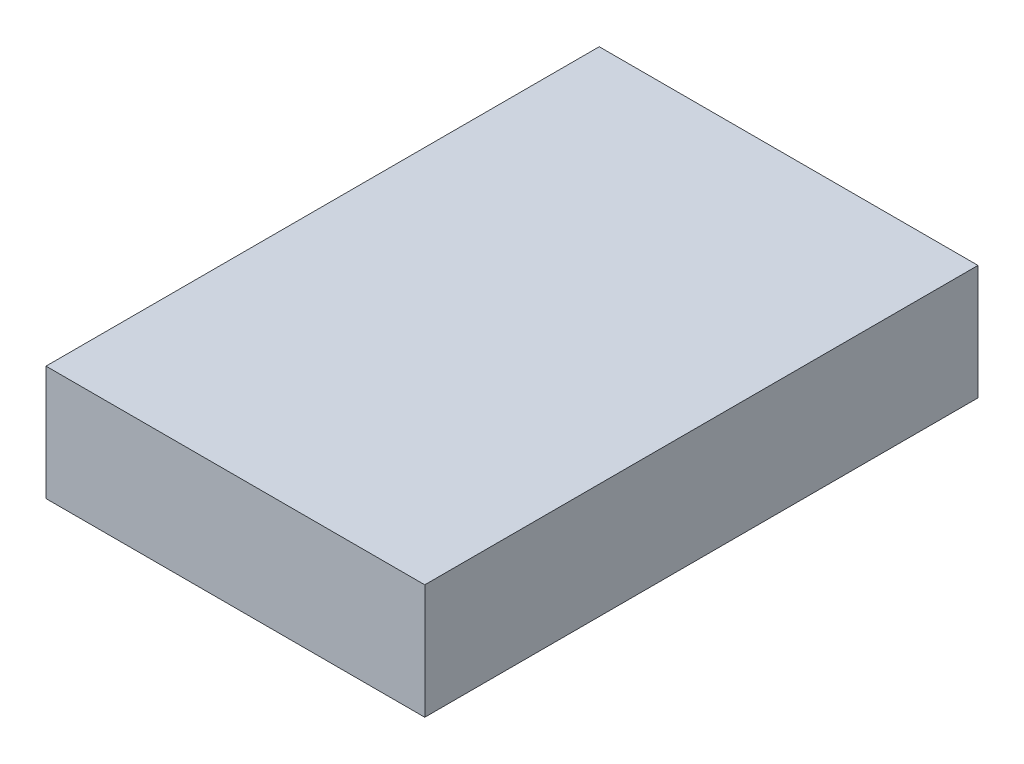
SolidWorks part; units mm, degrees
ref_plane "Front Plane" through (0, 0, 0) normal (0, 0, 1) x (1, 0, 0)
ref_plane "Top Plane" through (0, 0, 0) normal (0, 1, 0) x (1, 0, 0)
ref_plane "Right Plane" through (0, 0, 0) normal (1, 0, 0) x (0, 0, -1)
sketch "Sketch1" plane through (0, 0, 0) normal (0, 0, 1) x (1, 0, 0)
  line L1 (-97.5722, 21.2807) -> (22.9278, 21.2807)
  line L2 (-97.5722, 21.2807) -> (-97.5722, -15.2193)
  line L3 (-97.5722, -15.2193) -> (22.9278, -15.2193)
  line L4 (22.9278, 21.2807) -> (22.9278, -15.2193)
  dimension "D1" = 36.5
  dimension "D2" = 120.5
extrude "Boss-Extrude1" add sketch "Sketch1" along normal blind 176
ref_plane "Plane1" through (0, 0, 0) normal (0, 0, -1) x (-1, 0, 0)
sketch "Sketch2" plane through (0, 0, 0) normal (0, 0, -1) x (-1, 0, 0)
  line L0 (97.5722, -15.2193) -> (-22.9278, -15.2193) construction
  line L1 (97.5722, 21.2807) -> (97.5722, -15.2193) construction
  circle A0 centre (72.5722, -5.2193) radius 3
  dimension "D1" = 6
  dimension "D2" = 10
  dimension "D3" = 25
extrude "Cut-Extrude1" cut sketch "Sketch2" against normal blind 10
